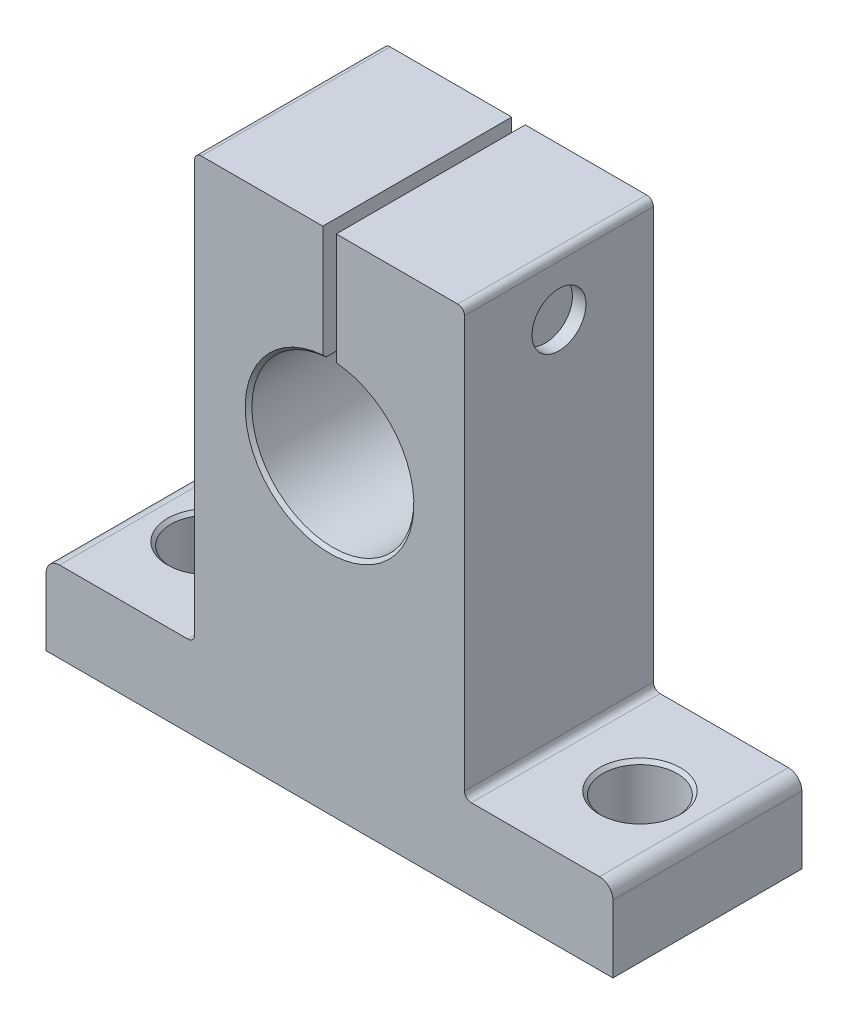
SolidWorks part; units mm, degrees
ref_plane "Front Plane" through (0, 0, 0) normal (0, 0, 1) x (1, 0, 0)
ref_plane "Top Plane" through (0, 0, 0) normal (0, 1, 0) x (1, 0, 0)
ref_plane "Right Plane" through (0, 0, 0) normal (1, 0, 0) x (0, 0, -1)
sketch "Sketch1" plane through (0, 0, 0) normal (0, 0, 1) x (1, 0, 0)
  line L0 (-21, 0) -> (21, 0)
  line L1 (-21, 0) -> (-21, 6)
  line L2 (-21, 6) -> (-10, 6)
  line L3 (-10, 6) -> (-10, 37.5)
  line L4 (-10, 37.5) -> (-0.5, 37.5)
  line L5 (10, 37.5) -> (10, 6)
  line L6 (10, 6) -> (21, 6)
  line L7 (21, 6) -> (21, 0)
  line L8 (-0.5, 37.5) -> (-0.5, 28.9791)
  line L9 (0.5, 37.5) -> (0.5, 28.9791)
  line L10 (0.5, 37.5) -> (10, 37.5)
  arc A0 (-0.5, 28.9791) -> (0.5, 28.9791) centre (0, 23) ccw
  point P11 (0, 0)
  point P13 (-0.5, 33.2396)
extrude "Boss-Extrude1" add sketch "Sketch1" along normal blind 14
sketch "Sketch3" plane through (0, 0, 0) normal (0, -1, 0) x (1, 0, 0)
  line L0 (-16, 7) -> (16, 7) construction
  line L1 (-21, 14) -> (-21, 0) construction
  line L2 (0, 7) -> (0, 0) construction
  circle A0 centre (-16, 7) radius 2.75
  circle A1 centre (16, 7) radius 2.75
  point P7 (-21, 7)
extrude "Cut-Extrude1" cut sketch "Sketch3" against normal blind 6 and the other way through all
fillet "Fillet1" radius 1 2 edges at (21, 6, 7) (-21, 6, 7)
fillet "Fillet2" radius 0.5 4 edges at (-10, 37.5, 7) (10, 37.5, 7) (10, 6, 7) (-10, 6, 7)
chamfer "Chamfer1" distance 0.25 6 edges at (-16, 0, 9.75) (16, 0, 9.75) (18.75, 6, 7) (-13.25, 6, 7) (0, 17, 0) (0, 17, 14)
sketch "Sketch4" plane through (-10, 0, 0) normal (-1, 0, 0) x (0, 0, 1)
  line L0 (14, 37) -> (0, 37) construction
  line L1 (0, 37.5) -> (14, 37.5) construction
  circle A0 centre (7, 33.25) radius 3.1
  point P6 (7, 37)
extrude "Cut-Extrude2" cut sketch "Sketch4" against normal blind 1
sketch "Sketch5" plane through (-9, 0, 0) normal (-1, 0, 0) x (0, 0, 1)
  circle A0 centre (7, 33.25) radius 3.1
  circle A1 centre (7, 33.25) radius 3
extrude "Cut-Extrude3" cut sketch "Sketch5" against normal blind 4
chamfer "Chamfer2" distance 0.2 1 edges at (-9, 30.25, 7)
sketch "Sketch6" plane through (-9, 0, 0) normal (-1, 0, 0) x (0, 0, 1)
  line L1 (7.2461, 31.5355) -> (8.6078, 32.6059)
  line L2 (8.6078, 32.6059) -> (8.3618, 34.3203)
  line L3 (8.3618, 34.3203) -> (6.7539, 34.9645)
  line L4 (6.7539, 34.9645) -> (5.3922, 33.8941)
  line L5 (5.3922, 33.8941) -> (5.6382, 32.1797)
  line L6 (5.6382, 32.1797) -> (7.2461, 31.5355)
  circle A0 centre (7, 33.25) radius 1.5 construction
extrude "Cut-Extrude4" cut sketch "Sketch6" against normal blind 2
sketch "Sketch7" plane through (-0.5, 0, 0) normal (1, 0, 0) x (0, 0, -1)
  circle A0 centre (-7, 33.25) radius 2
extrude "Boss-Extrude2" add sketch "Sketch7" along normal blind 1
sketch "Sketch8" plane through (10, 0, 0) normal (1, 0, 0) x (0, 0, -1)
  circle A0 centre (-7, 33.25) radius 2
extrude "Cut-Extrude5" cut sketch "Sketch8" against normal blind 1
sketch "Sketch9" plane through (-9, 0, 0) normal (-1, 0, 0) x (0, 0, 1)
  circle A0 centre (7, 33.25) radius 1.7321
extrude "Cut-Extrude6" cut sketch "Sketch9" against normal blind 1 draft 45
equation "\"h\"= 23'6"
equation "\"w\"= 42'1"
equation "\"l\"= 14'3"
equation "\"f\"= 37.5'2"
equation "\"g\"= 6'9"
equation "\"p\"= 20'5"
equation "\"b\"= 32'4"
equation "\"s\"= 5.5'10"
equation "\"sk\"= 12'7 dg kinh truc"
equation "\"D1@Sketch1\"=\"w\""
equation "\"D2@Sketch1\"=\"g\""
equation "\"D3@Sketch1\"=\"h\""
equation "\"D4@Sketch1\"=\"f\""
equation "\"rk\"= 1'11 be rong khe"
equation "\"D5@Sketch1\"=\"rk\""
equation "\"D6@Sketch1\"=\"sk\"/2"
equation "\"D1@Boss-Extrude1\"=\"l\""
equation "\"D1@Sketch3\"=\"b\""
equation "\"D2@Sketch3\"=\"s\""
equation "\"D1@Cut-Extrude1\"=\"g\""
equation "\"D7@Sketch1\"=\"p\""
equation "\"bo\"= 1'12 bo goc"
equation "\"D1@Fillet1\"=\"bo\""
equation "\"D1@Fillet2\"=\"bo\"/2"
equation "\"D1@Chamfer1\"=\"bo\"/4"
equation "\"m\"= 4'8 bu long"
equation "\"D1@Sketch4\"=1.5*\"m\"+0.2"
equation "\"D1@Sketch5\"=\"m\"*1.5"
equation "\"D2@Sketch5\"=\"m\"*1.5+0.2"
equation "\"D1@Cut-Extrude3\"=\"m\""
equation "\"D1@Chamfer2\"=\"m\"*0.05"
equation "\"D1@Cut-Extrude4\"=\"m\"/2"
equation "\"D1@Sketch6\"=\"m\"*3/4"
equation "\"D1@Sketch7\"=\"m\""
equation "\"D1@Boss-Extrude2\"=\"rk\""
equation "\"D1@Sketch8\"=\"m\""
equation "\"D2@Sketch4\"=(\"f\"-\"h\"-\"sk\"/2)/2"
